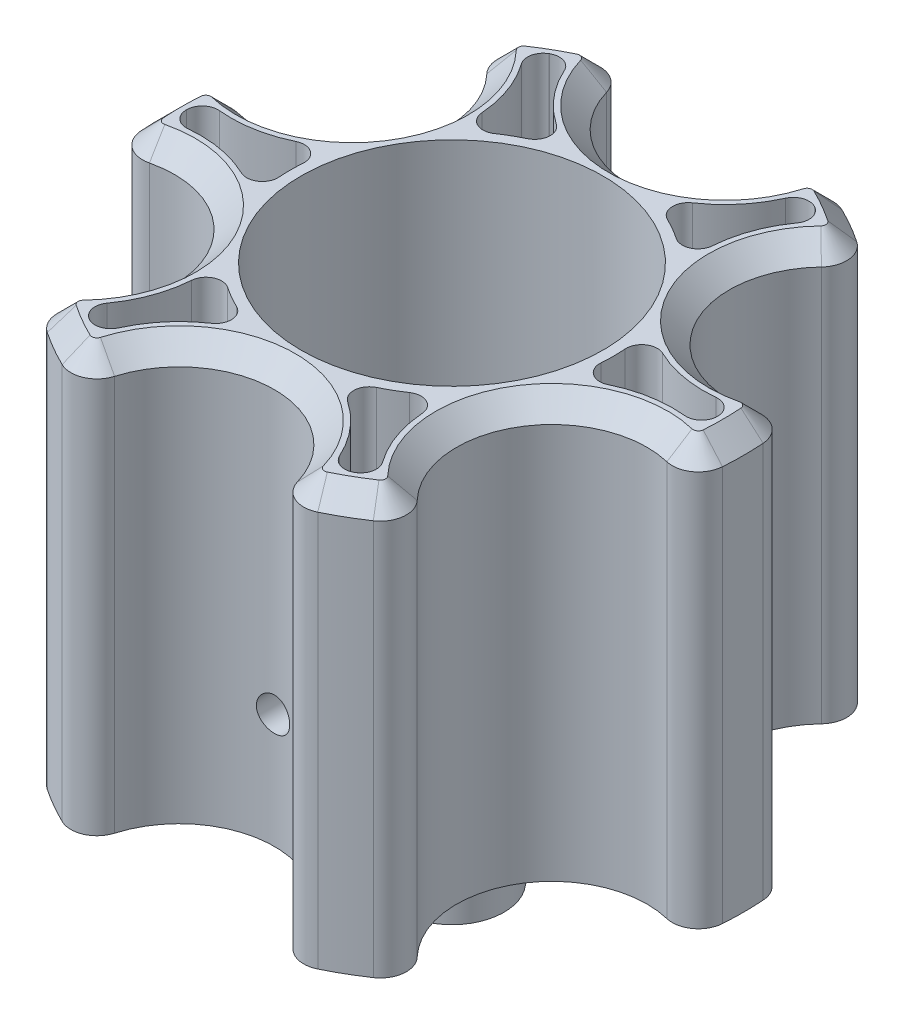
SolidWorks part; units mm, degrees
ref_plane "前视基准面" through (0, 0, 0) normal (0, 0, 1) x (1, 0, 0)
ref_plane "上视基准面" through (0, 0, 0) normal (0, 1, 0) x (1, 0, 0)
ref_plane "右视基准面" through (0, 0, 0) normal (1, 0, 0) x (0, 0, -1)
sketch "草图1" plane through (0, 0, 0) normal (0, 1, 0) x (1, 0, 0)
  line L0 (0, 0) -> (0, 57.3141) construction
  arc A0 (-27.4917, 5.3112) -> (-27.4917, -5.3112) centre (0, 0) ccw
  arc A1 (-9.1462, 26.4641) -> (9.1462, 26.4641) centre (0, 26.2) ccw
  arc A2 (18.3455, 21.1529) -> (27.4917, 5.3112) centre (22.6899, 13.1) ccw
  arc A3 (27.4917, -5.3112) -> (18.3455, -21.1529) centre (22.6899, -13.1) ccw
  arc A4 (9.1462, -26.4641) -> (-9.1462, -26.4641) centre (0, -26.2) ccw
  arc A5 (-18.3455, -21.1529) -> (-27.4917, -5.3112) centre (-22.6899, -13.1) ccw
  arc A6 (-27.4917, 5.3112) -> (-18.3455, 21.1529) centre (-22.6899, 13.1) ccw
  arc A7 (-9.1462, 26.4641) -> (-18.3455, 21.1529) centre (0, 0) ccw
  arc A8 (18.3455, 21.1529) -> (9.1462, 26.4641) centre (0, 0) ccw
  arc A9 (27.4917, -5.3112) -> (27.4917, 5.3112) centre (0, 0) ccw
  arc A10 (9.1462, -26.4641) -> (18.3455, -21.1529) centre (0, 0) ccw
  arc A11 (-18.3455, -21.1529) -> (-9.1462, -26.4641) centre (0, 0) ccw
  point P19 (0, 0)
  dimension "D1" = 56
  dimension "D2" = 18.3
  dimension "D4" = 26.2
  dimension "D3" = 6
extrude "凸台-拉伸1" add sketch "草图1" along normal blind 40
fillet "圆角1" radius 2.5 12 edges at (27.4917, 20, 5.3112) (18.3455, 20, 21.1529) (9.1462, 20, 26.4641) (-27.4917, 20, 5.3112) (-27.4917, 20, -5.3112) (-18.3455, 20, -21.1529) (-9.1462, 20, -26.4641) (9.1462, 20, -26.4641) (18.3455, 20, -21.1529) (27.4917, 20, -5.3112) (-18.3455, 20, 21.1529) (-9.1462, 20, 26.4641)
chamfer "倒角1" distance 2 angle 45 24 edges at (16.7449, 40, 21.4095) (14, 40, 24.2487) (10.1688, 40, 25.2062) (0, 40, 17.05) (-10.1688, 40, 25.2062) (-14, 40, 24.2487) (-16.7449, 40, 21.4095) (-14.7657, 40, 8.525) (-26.9136, 40, 3.7967) (-28, 40, 0) (-26.9136, 40, -3.7967) (-14.7657, 40, -8.525) (-16.7449, 40, -21.4095) (-14, 40, -24.2487) (-10.1688, 40, -25.2062) (0, 40, -17.05) (10.1688, 40, -25.2062) (14, 40, -24.2487) (16.7449, 40, -21.4095) (14.7657, 40, -8.525) (26.9136, 40, -3.7967) (28, 40, 0) (26.9136, 40, 3.7967) (14.7657, 40, 8.525)
sketch "草图2" plane through (0, 40, 0) normal (0, 1, 0) x (1, 0, 0)
  circle A0 centre (0, 0) radius 14.5
  dimension "D1" = 29
extrude "切除-拉伸1" cut sketch "草图2" against normal blind 38
sketch "草图3" plane through (0, 2, 0) normal (0, 1, 0) x (1, 0, 0)
  circle A0 centre (0, 0) radius 3
  circle A1 centre (0, 0) radius 6
  dimension "D1" = 6
  dimension "D2" = 12
extrude "凸台-拉伸2" add sketch "草图3" along normal blind 13.5
sketch "草图4" plane through (0, 0, 0) normal (0, -1, 0) x (1, 0, 0)
  circle A0 centre (0, 0) radius 1.6
  dimension "D1" = 3.2
extrude "切除-拉伸2" cut sketch "草图4" against normal blind 12
sketch "草图5" plane through (0, 0, 0) normal (0, 0, 1) x (1, 0, 0)
  line L0 (0, 79.4842) -> (0, -37.644) construction
  line L1 (-8.7797, 0) -> (8.7797, 0) construction
  circle A0 centre (0, 11) radius 1.25
  dimension "D1" = 11
  dimension "D2" = 2.5
extrude "切除-拉伸3" cut sketch "草图5" against normal mid plane 50
sketch "草图6" plane through (0, 0, 0) normal (0, 0, 1) x (1, 0, 0)
  circle A0 centre (0, 11) radius 3
  dimension "D1" = 6
extrude "切除-拉伸4" cut sketch "草图6" against normal blind 50 from offset 10
sketch "草图7" plane through (0, 0, 0) normal (0, -1, 0) x (1, 0, 0)
  circle A0 centre (0, 0) radius 3
  circle A1 centre (0, 0) radius 5
  dimension "D1" = 6
  dimension "D2" = 10
extrude "凸台-拉伸3" add sketch "草图7" along normal blind 11.5
sketch "草图8" plane through (0, 0, 0) normal (0, -1, 0) x (1, 0, 0)
  circle A0 centre (0, 0) radius 5
  circle A1 centre (0, 0) radius 6
  dimension "D1" = 10
  dimension "D2" = 12
extrude "凸台-拉伸4" add sketch "草图8" along normal blind 1
sketch "草图9" plane through (0, 15.5, 0) normal (0, 1, 0) x (1, 0, 0)
  circle A1 centre (0, 0) radius 6
  circle A2 centre (0, 0) radius 6
  dimension "D1" = 0
extrude "切除-拉伸5" cut sketch "草图9" against normal blind 1
sketch "草图12" plane through (0, 0, 0) normal (0, 0, 1) x (1, 0, 0)
  circle A0 centre (0, 11) radius 1.6
  circle A1 centre (0, 11) radius 1.25 construction
  dimension "D1" = 3.2
extrude "切除-拉伸7" cut sketch "草图12" against normal blind 8
sketch "草图13" plane through (0, 0, 0) normal (0, 0, 1) x (1, 0, 0)
  circle A0 centre (0, 11) radius 1.6
  circle A1 centre (0, 11) radius 1.25 construction
  circle A2 centre (0, 11) radius 1.25 construction
  dimension "D1" = 3.2
extrude "切除-拉伸8" cut sketch "草图13" along normal blind 8 from offset 12
sketch "草图14" plane through (0, 40, 0) normal (0, 1, 0) x (1, 0, 0)
  arc A0 (11.1785, -22.9192) -> (14.2594, -21.1405) centre (0, 0) ccw
  arc A1 (14.2594, -21.1405) -> (14.2594, -21.1405) centre (14.2594, -21.1405) ccw
  arc A2 (25.4379, -1.7787) -> (14.2594, -21.1405) centre (22.6899, -13.1) ccw
  arc A3 (25.4379, -1.7787) -> (25.4379, -1.7787) centre (25.4379, -1.7787) ccw
  arc A4 (25.4379, -1.7787) -> (25.4379, 1.7787) centre (0, 0) ccw
  arc A5 (25.4379, 1.7787) -> (25.4379, 1.7787) centre (25.4379, 1.7787) ccw
  arc A6 (14.2594, 21.1405) -> (25.4379, 1.7787) centre (22.6899, 13.1) ccw
  arc A7 (14.2594, 21.1405) -> (14.2594, 21.1405) centre (14.2594, 21.1405) ccw
  arc A8 (14.2594, 21.1405) -> (11.1785, 22.9192) centre (0, 0) ccw
  arc A9 (11.1785, 22.9192) -> (11.1785, 22.9192) centre (11.1785, 22.9192) ccw
  arc A10 (-11.1785, 22.9192) -> (11.1785, 22.9192) centre (0, 26.2) ccw
  arc A11 (-11.1785, 22.9192) -> (-11.1785, 22.9192) centre (-11.1785, 22.9192) ccw
  arc A12 (-11.1785, 22.9192) -> (-14.2594, 21.1405) centre (0, 0) ccw
  arc A13 (-14.2594, 21.1405) -> (-14.2594, 21.1405) centre (-14.2594, 21.1405) ccw
  arc A14 (-25.4379, 1.7787) -> (-14.2594, 21.1405) centre (-22.6899, 13.1) ccw
  arc A15 (-25.4379, 1.7787) -> (-25.4379, 1.7787) centre (-25.4379, 1.7787) ccw
  arc A16 (-25.4379, 1.7787) -> (-25.4379, -1.7787) centre (0, 0) ccw
  arc A17 (-25.4379, -1.7787) -> (-25.4379, -1.7787) centre (-25.4379, -1.7787) ccw
  arc A18 (-14.2594, -21.1405) -> (-25.4379, -1.7787) centre (-22.6899, -13.1) ccw
  arc A19 (-14.2594, -21.1405) -> (-14.2594, -21.1405) centre (-14.2594, -21.1405) ccw
  arc A20 (-14.2594, -21.1405) -> (-11.1785, -22.9192) centre (0, 0) ccw
  arc A21 (-11.1785, -22.9192) -> (-11.1785, -22.9192) centre (-11.1785, -22.9192) ccw
  arc A22 (11.1785, -22.9192) -> (-11.1785, -22.9192) centre (0, -26.2) ccw
  arc A23 (11.1785, -22.9192) -> (11.1785, -22.9192) centre (11.1785, -22.9192) ccw
  arc A24 (11.3977, -23.3686) -> (14.539, -21.555) centre (0, 0) ccw
  arc A25 (14.539, -21.555) -> (14.6212, -20.7954) centre (14.2594, -21.1405) ccw
  arc A26 (25.3199, -2.2646) -> (14.6212, -20.7954) centre (22.6899, -13.1) ccw
  arc A27 (25.3199, -2.2646) -> (25.9367, -1.8136) centre (25.4379, -1.7787) ccw
  arc A28 (25.9367, -1.8136) -> (25.9367, 1.8136) centre (0, 0) ccw
  arc A29 (25.9367, 1.8136) -> (25.3199, 2.2646) centre (25.4379, 1.7787) ccw
  arc A30 (14.6212, 20.7954) -> (25.3199, 2.2646) centre (22.6899, 13.1) ccw
  arc A31 (14.6212, 20.7954) -> (14.539, 21.555) centre (14.2594, 21.1405) ccw
  arc A32 (14.539, 21.555) -> (11.3977, 23.3686) centre (0, 0) ccw
  arc A33 (11.3977, 23.3686) -> (10.6987, 23.06) centre (11.1785, 22.9192) ccw
  arc A34 (-10.6987, 23.06) -> (10.6987, 23.06) centre (0, 26.2) ccw
  arc A35 (-10.6987, 23.06) -> (-11.3977, 23.3686) centre (-11.1785, 22.9192) ccw
  arc A36 (-11.3977, 23.3686) -> (-14.539, 21.555) centre (0, 0) ccw
  arc A37 (-14.539, 21.555) -> (-14.6212, 20.7954) centre (-14.2594, 21.1405) ccw
  arc A38 (-25.3199, 2.2646) -> (-14.6212, 20.7954) centre (-22.6899, 13.1) ccw
  arc A39 (-25.3199, 2.2646) -> (-25.9367, 1.8136) centre (-25.4379, 1.7787) ccw
  arc A40 (-25.9367, 1.8136) -> (-25.9367, -1.8136) centre (0, 0) ccw
  arc A41 (-25.9367, -1.8136) -> (-25.3199, -2.2646) centre (-25.4379, -1.7787) ccw
  arc A42 (-14.6212, -20.7954) -> (-25.3199, -2.2646) centre (-22.6899, -13.1) ccw
  arc A43 (-14.6212, -20.7954) -> (-14.539, -21.555) centre (-14.2594, -21.1405) ccw
  arc A44 (-14.539, -21.555) -> (-11.3977, -23.3686) centre (0, 0) ccw
  arc A45 (-11.3977, -23.3686) -> (-10.6987, -23.06) centre (-11.1785, -22.9192) ccw
  arc A46 (10.6987, -23.06) -> (-10.6987, -23.06) centre (0, -26.2) ccw
  arc A47 (10.6987, -23.06) -> (11.3977, -23.3686) centre (11.1785, -22.9192) ccw
  arc A48 (11.3977, -23.3686) -> (14.539, -21.555) centre (0, 0) ccw
  arc A49 (14.539, -21.555) -> (14.6212, -20.7954) centre (14.2594, -21.1405) ccw
  arc A50 (25.3199, -2.2646) -> (14.6212, -20.7954) centre (22.6899, -13.1) ccw
  arc A51 (25.3199, -2.2646) -> (25.9367, -1.8136) centre (25.4379, -1.7787) ccw
  arc A52 (25.9367, -1.8136) -> (25.9367, 1.8136) centre (0, 0) ccw
  arc A53 (25.9367, 1.8136) -> (25.3199, 2.2646) centre (25.4379, 1.7787) ccw
  arc A54 (14.6212, 20.7954) -> (25.3199, 2.2646) centre (22.6899, 13.1) ccw
  arc A55 (14.6212, 20.7954) -> (14.539, 21.555) centre (14.2594, 21.1405) ccw
  arc A56 (14.539, 21.555) -> (11.3977, 23.3686) centre (0, 0) ccw
  arc A57 (11.3977, 23.3686) -> (10.6987, 23.06) centre (11.1785, 22.9192) ccw
  arc A58 (-10.6987, 23.06) -> (10.6987, 23.06) centre (0, 26.2) ccw
  arc A59 (-10.6987, 23.06) -> (-11.3977, 23.3686) centre (-11.1785, 22.9192) ccw
  arc A60 (-11.3977, 23.3686) -> (-14.539, 21.555) centre (0, 0) ccw
  arc A61 (-14.539, 21.555) -> (-14.6212, 20.7954) centre (-14.2594, 21.1405) ccw
  arc A62 (-25.3199, 2.2646) -> (-14.6212, 20.7954) centre (-22.6899, 13.1) ccw
  arc A63 (-25.3199, 2.2646) -> (-25.9367, 1.8136) centre (-25.4379, 1.7787) ccw
  arc A64 (-25.9367, 1.8136) -> (-25.9367, -1.8136) centre (0, 0) ccw
  arc A65 (-25.9367, -1.8136) -> (-25.3199, -2.2646) centre (-25.4379, -1.7787) ccw
  arc A66 (-14.6212, -20.7954) -> (-25.3199, -2.2646) centre (-22.6899, -13.1) ccw
  arc A67 (-14.6212, -20.7954) -> (-14.539, -21.555) centre (-14.2594, -21.1405) ccw
  arc A68 (-14.539, -21.555) -> (-11.3977, -23.3686) centre (0, 0) ccw
  arc A69 (-11.3977, -23.3686) -> (-10.6987, -23.06) centre (-11.1785, -22.9192) ccw
  arc A70 (10.6987, -23.06) -> (-10.6987, -23.06) centre (0, -26.2) ccw
  arc A71 (10.6987, -23.06) -> (11.3977, -23.3686) centre (11.1785, -22.9192) ccw
  circle A72 centre (0, 0) radius 15.5
  circle A73 centre (0, 0) radius 14.5 construction
  dimension "D2" = 0.5
  dimension "D3" = 1
  dimension "D1" = 0
extrude "切除-拉伸9" cut sketch "草图14" against normal offset from surface (38.5 mm away) 1.5 contours A72 A2 A4 A6 | A72 A6 A8 A10 | A72 A10 A12 A14 | A72 A14 A16 A18 | A72 A18 A20 A22 | A72 A22 A0 A2
fillet "圆角4" radius 1.5 24 edges at (11.1785, 20.75, -22.9192) (3.5209, 20.75, -15.0948) (-3.5209, 20.75, -15.0948) (14.833, 20.75, -4.4982) (11.312, 20.75, -10.5966) (14.2594, 20.75, -21.1405) (-14.2594, 20.75, -21.1405) (-11.312, 20.75, -10.5966) (-14.833, 20.75, -4.4982) (-11.1785, 20.75, -22.9192) (-25.4379, 20.75, 1.7787) (-14.833, 20.75, 4.4982) (-11.312, 20.75, 10.5966) (-25.4379, 20.75, -1.7787) (-11.1785, 20.75, 22.9192) (-3.5209, 20.75, 15.0948) (3.5209, 20.75, 15.0948) (-14.2594, 20.75, 21.1405) (14.2594, 20.75, 21.1405) (14.833, 20.75, 4.4982) (11.312, 20.75, 10.5966) (11.1785, 20.75, 22.9192) (25.4379, 20.75, -1.7787) (25.4379, 20.75, 1.7787)
